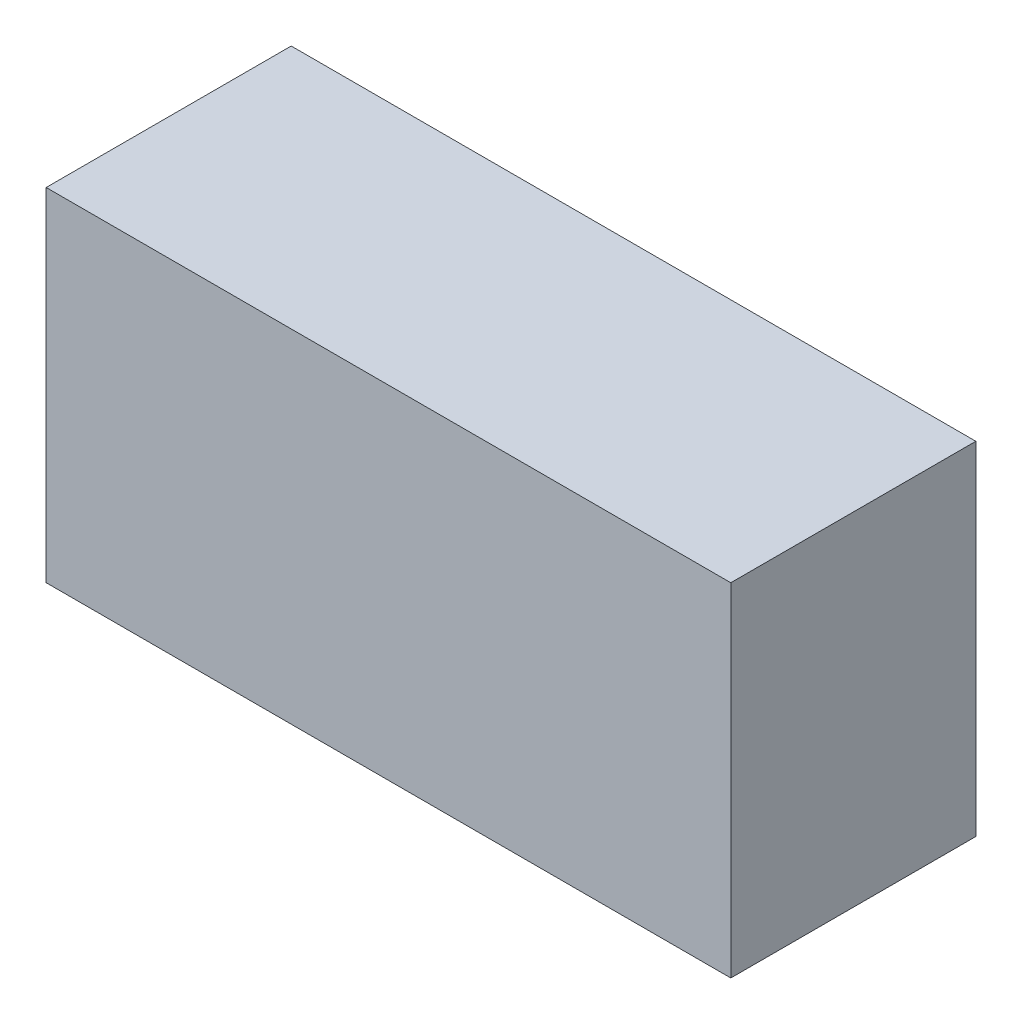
SolidWorks part; units mm, degrees
ref_plane "Front Plane" through (0, 0, 0) normal (0, 0, 1) x (1, 0, 0)
ref_plane "Top Plane" through (0, 0, 0) normal (0, 1, 0) x (1, 0, 0)
ref_plane "Right Plane" through (0, 0, 0) normal (1, 0, 0) x (0, 0, -1)
sketch "Component_Outline" plane through (0, 0, 0) normal (0, 0, 1) x (1, 0, 0)
  line L0 (-0.5588, 0.2794) -> (0.5588, 0.2794)
  line L1 (0.5588, 0.2794) -> (0.5588, -0.2794)
  line L2 (0.5588, -0.2794) -> (-0.5588, -0.2794)
  line L3 (-0.5588, -0.2794) -> (-0.5588, 0.2794)
extrude "Boss-Extrude1" add sketch "Component_Outline" along normal blind 0.4
